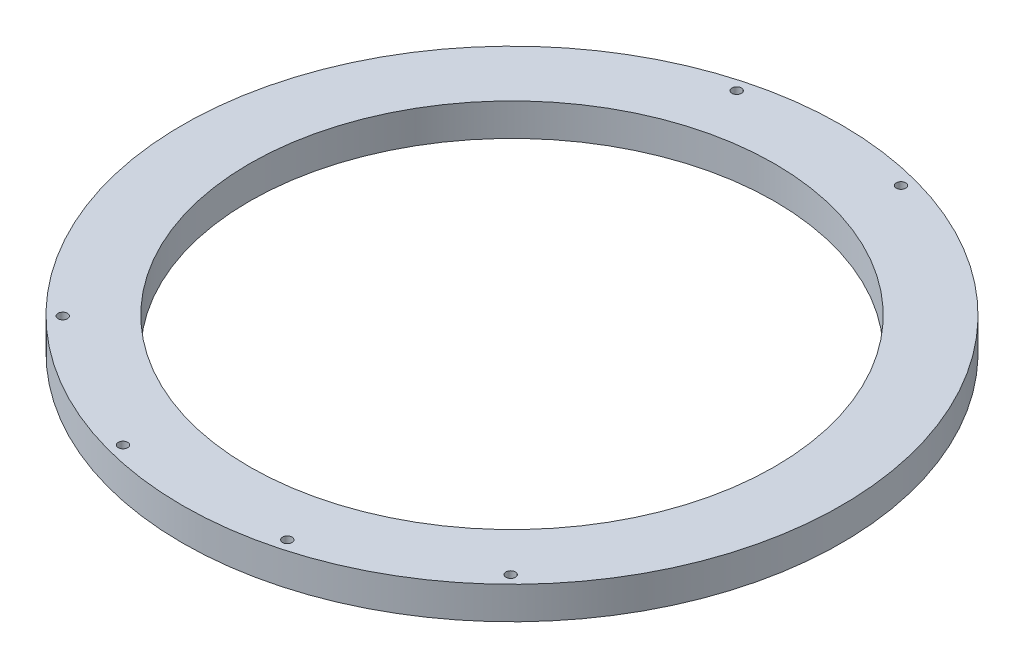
SolidWorks part; units mm, degrees
ref_plane "Front Plane" through (0, 0, 0) normal (0, 0, 1) x (1, 0, 0)
ref_plane "Top Plane" through (0, 0, 0) normal (0, 1, 0) x (1, 0, 0)
ref_plane "Right Plane" through (0, 0, 0) normal (1, 0, 0) x (0, 0, -1)
sketch "Sketch1" plane through (0, 0, 0) normal (0, 1, 0) x (1, 0, 0)
  circle A0 centre (0, 0) radius 32.7152
  circle A1 centre (0, 0) radius 26.0604
  dimension "D1" = 52.1208
  dimension "D2" = 65.4304
extrude "Boss-Extrude1" add sketch "Sketch1" along normal blind 3.2258
sketch "Sketch2" plane through (0, 3.2258, 0) normal (0, 1, 0) x (1, 0, 0)
  line L0 (-8.1534, 30.4618) -> (0, 0) construction
  line L1 (0, 0) -> (8.1534, 30.4618) construction
  line L2 (-22.2313, -22.3644) -> (0, 0) construction
  line L3 (0, 0) -> (-8.1534, -30.4618) construction
  line L4 (8.1534, -30.4618) -> (0, 0) construction
  line L5 (0, 0) -> (22.2313, -22.3644) construction
  line L6 (0, 0) -> (0, 31.5341) construction
  line L7 (-8.1534, 30.4618) -> (8.1534, 30.4618) construction
  line L8 (-8.1534, -30.4618) -> (8.1534, -30.4618) construction
  line L9 (-22.2313, -22.3644) -> (22.2313, -22.3644) construction
  circle A0 centre (-8.1534, 30.4618) radius 0.4699
  circle A1 centre (8.1534, 30.4618) radius 0.4699
  circle A2 centre (-22.2313, -22.3644) radius 0.4699
  circle A3 centre (-8.1534, -30.4618) radius 0.4699
  circle A4 centre (8.1534, -30.4618) radius 0.4699
  circle A5 centre (22.2313, -22.3644) radius 0.4699
  circle A6 centre (0, 0) radius 31.5341 construction
  circle A7 centre (0, 0) radius 32.7152 construction
  circle A8 centre (0, 0) radius 32.004 construction
  point P18 (0, 30.4618)
  point P20 (0, -30.4618)
  point P21 (0, -22.3644)
  point P22 (-16.4435, -26.9075)
  dimension "D1" = 0.9398
  dimension "D2" = 0.7112
  dimension "D3" = 16.3068
  dimension "D4" = 44.4627
extrude "Cut-Extrude1" cut sketch "Sketch2" against normal through all
